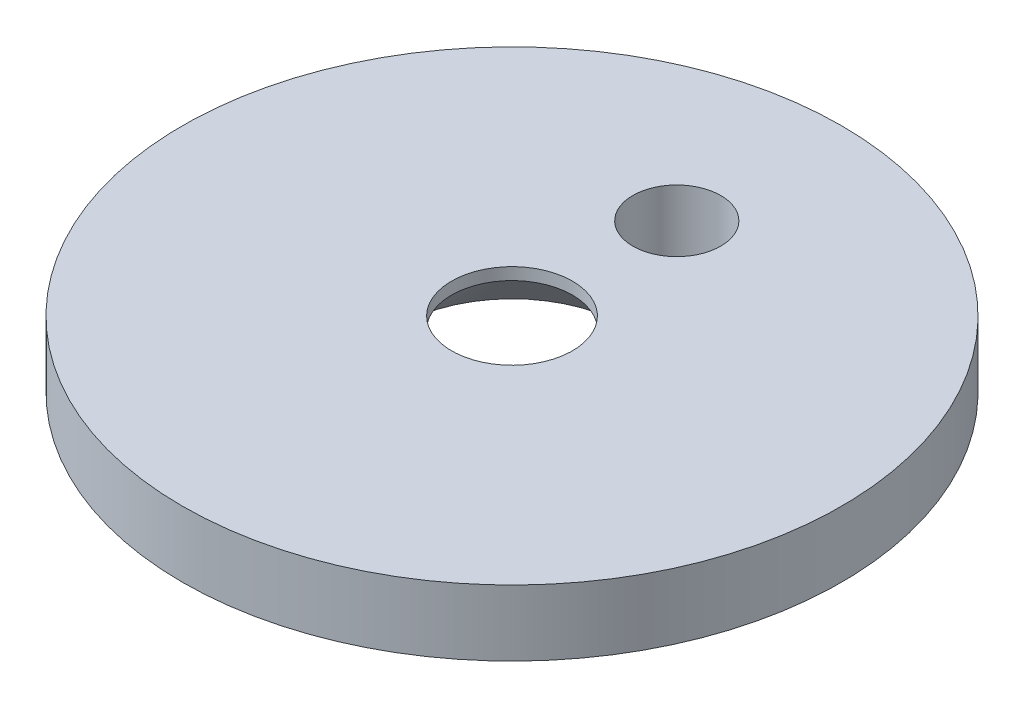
SolidWorks part; units mm, degrees
ref_plane "Front" through (0, 0, 0) normal (0, 0, 1) x (1, 0, 0)
ref_plane "Top" through (0, 0, 0) normal (0, 1, 0) x (1, 0, 0)
ref_plane "Right" through (0, 0, 0) normal (1, 0, 0) x (0, 0, -1)
sketch "Sketch1" plane through (0, 0, 0) normal (0, 1, 0) x (1, 0, 0)
  circle A0 centre (0, 0) radius 2.5
  circle A1 centre (0, 0) radius 15
  circle A2 centre (0, 7.5) radius 2
  dimension "D1" = 5
extrude "Extrude1" add sketch "Sketch1" along normal blind 3
sketch "Sketch5" plane through (0, 0, 0) normal (0, -1, 0) x (1, 0, 0)
  line L0 (14.1421, 5) -> (-14.1421, 5) construction
  line L1 (5, 14.1421) -> (5, -14.1421) construction
  line L2 (-15, 0) -> (15, 0) construction
  line L3 (0, -15) -> (0, 15) construction
  circle A0 centre (0, 0) radius 15 construction
  point P0 (0, 0)
  dimension "D1" = 5
  dimension "D2" = 5
  dimension "D3" = 5
  dimension "D4" = 5
hole_wizard "CSK for M5 Countersunk Flat Head Screw1" positions "3DSketch3" profile "Sketch6" countersink size "M5" standard "ISO"
sketch3d "3DSketch3"
  point P0 (0, 0, 0)
sketch "Sketch6" plane through (0, 0, 0) normal (1, 0, 0) x (0, 0, -1)
  line L0 (0, 0) -> (0, 3)
  line L1 (0, 3) -> (2.75, 3)
  line L2 (2.75, 3) -> (2.75, 2.45)
  line L3 (2.75, 2.45) -> (5.2, 0)
  line L5 (5.2, 0) -> (0, 0)
  line L6 (-2.75, 2.45) -> (-5.2, 0) construction
  line L11 (0, -6.35) -> (0, 107.95) construction
  dimension "Thru Hole Dia." = 5.5
  dimension "Thru Hole Depth" = 3
  dimension "Near C'Sink Dia." = 10.4
  dimension "Near C'Sink Angle" = 90
